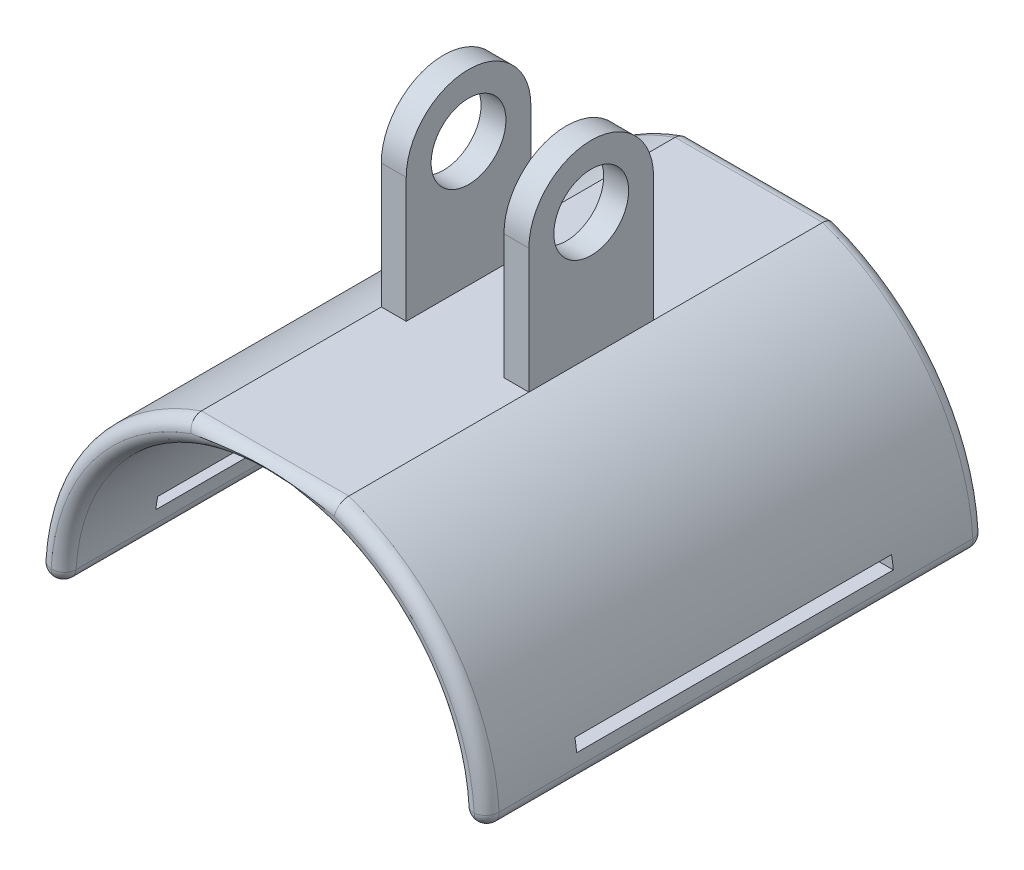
SolidWorks part; units mm, degrees
ref_plane "Front Plane" through (0, 0, 0) normal (0, 0, 1) x (1, 0, 0)
ref_plane "Top Plane" through (0, 0, 0) normal (0, 1, 0) x (1, 0, 0)
ref_plane "Right Plane" through (0, 0, 0) normal (1, 0, 0) x (0, 0, -1)
sketch "Sketch1" plane through (0, 0, 0) normal (0, 0, 1) x (1, 0, 0)
  line L0 (-9, 0) -> (9, 0)
  arc A0 (9, 0) -> (-9, 0) centre (0, 0) ccw
  point P3 (0, 0)
  dimension "D1" = 18
extrude "Boss-Extrude1" add sketch "Sketch1" along normal blind 20
sketch "Sketch2" plane through (0, 0, 0) normal (0, 0, -1) x (-1, 0, 0)
  circle A2 centre (0, 0) radius 8
  dimension "D1" = 16
extrude "Cut-Extrude1" cut sketch "Sketch2" against normal up to surface (20 mm away)
sketch "Sketch7" plane through (0, 0, 0) normal (1, 0, 0) x (0, 0, -1)
  line L0 (0, 0) -> (-20, 0)
  line L1 (-3.65, 1) -> (-16.35, 1)
  line L2 (-3.65, 1) -> (-3.65, 1.5)
  line L3 (-3.65, 1.5) -> (-16.35, 1.5)
  line L4 (-16.35, 1) -> (-16.35, 1.5)
  line L5 (-3.65, 1) -> (-16.35, 1.5) construction
  line L6 (-3.65, 1.5) -> (-16.35, 1) construction
  point P0 (-10, 1.25)
  dimension "D1" = 12.7
  dimension "D2" = 10
  dimension "D3" = 0.5
  dimension "D4" = 20
  dimension "D5" = 1
extrude "Cut-Extrude2" cut sketch "Sketch7" against normal up to surface and the other way up to surface contours L2 L1 L4 L3
sketch "Sketch8" plane through (0, 0, 20) normal (0, 0, 1) x (1, 0, 0)
  line L1 (5, 8.5) -> (-5, 8.5)
  line L2 (5, 8.5) -> (5, 9.5)
  line L3 (5, 9.5) -> (-5, 9.5)
  line L4 (-5, 8.5) -> (-5, 9.5)
  line L5 (5, 8.5) -> (-5, 9.5) construction
  line L6 (5, 9.5) -> (-5, 8.5) construction
  arc A0 (9, 0) -> (-9, 0) centre (0, 0) ccw construction
  point P0 (0, 9)
  dimension "D1" = 1
  dimension "D2" = 10
extrude "Cut-Extrude3" cut sketch "Sketch8" against normal up to surface (20 mm away)
fillet "Fillet1" radius 0.5 12 edges at (9, 0, 10) (-9, 0, 10) (-8, 0, 10) (8, 0, 10) (0, 8, 0) (-7.3356, 5.2143, 0) (7.3356, 5.2143, 0) (0, 8.5, 0) (-7.3356, 5.2143, 20) (7.3356, 5.2143, 20) (0, 8, 20) (0, 8.5, 20)
ref_plane "Plane3" through (2.96, 0, 0) normal (1, 0, 0) x (0, 0, -1)
sketch "Sketch18" plane through (2.96, 0, 0) normal (1, 0, 0) x (0, 0, -1)
  line L0 (-0.5, 8.5) -> (-19.5, 8.5) construction
  line L1 (-12.2826, 8.5) -> (-7.2826, 8.5)
  line L2 (-12.2826, 8.5) -> (-12.2826, 13.5)
  line L3 (-12.2826, 13.5) -> (-7.2826, 13.5)
  line L4 (-7.2826, 8.5) -> (-7.2826, 13.5)
  circle A0 centre (-9.7826, 13.5) radius 2.5
  circle A1 centre (-9.7826, 13.5) radius 1.5
extrude "Boss-Extrude4" add sketch "Sketch18" against normal blind 1 contours A1 L3 A0 | A1 L3 A0 | A0 L2 L1 L4
mirror "Mirror1" about plane through (0, 0, 0) normal (1, 0, 0) of "Boss-Extrude4"
equation "\"connector height\"= 3mm"
equation "\"screw diameter\"= 3mm"
equation "\"D3@Sketch18\"=\"screw diameter\""
equation "\"connector circle diameter\"= 5mm"
equation "\"D1@Sketch18\"=\"connector circle diameter\""
